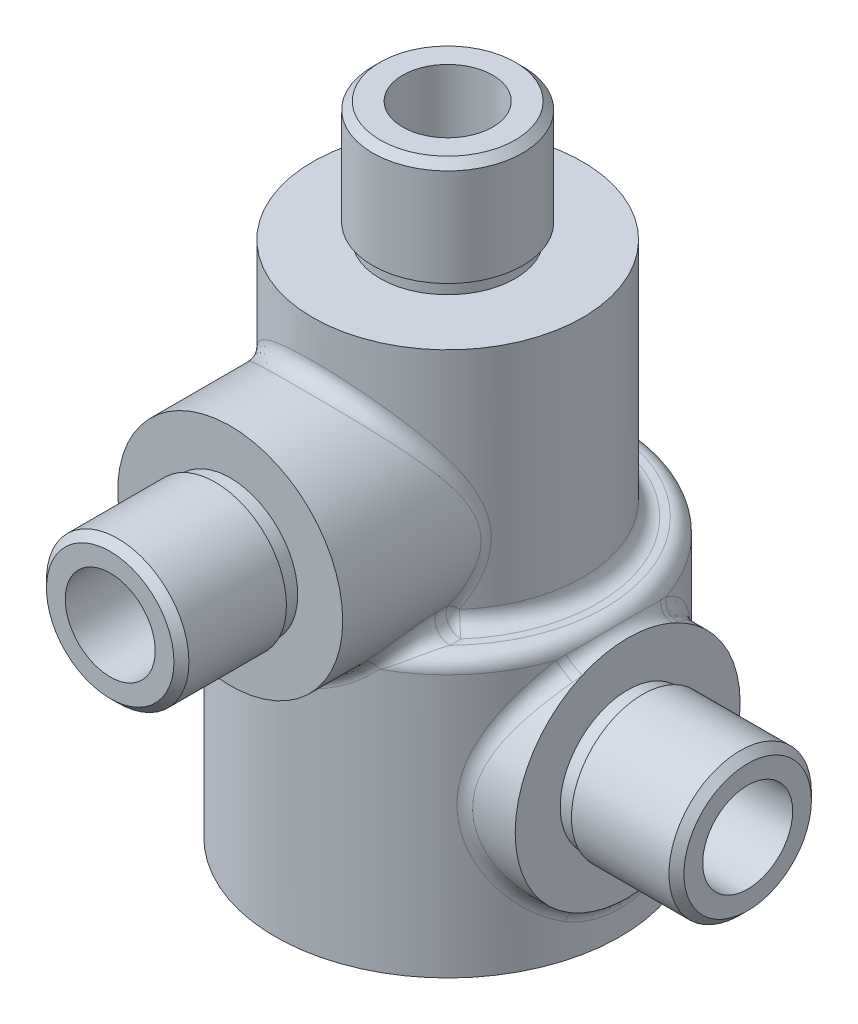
SolidWorks part; units mm, degrees
ref_plane "前视" through (0, 0, 0) normal (0, 0, 1) x (1, 0, 0)
ref_plane "上视" through (0, 0, 0) normal (0, 1, 0) x (1, 0, 0)
ref_plane "右视" through (0, 0, 0) normal (1, 0, 0) x (0, 0, -1)
sketch "草图1" plane through (0, 0, 0) normal (0, 0, 1) x (1, 0, 0)
  line L0 (0, 101.854) -> (0, -107.442) construction
  line L1 (0, -48.514) -> (-18, -48.514)
  line L2 (-18, -48.514) -> (-18, 20.486)
  line L3 (-18, 20.486) -> (-9, 20.486)
  line L4 (-9, 20.486) -> (-9, 36.486)
  line L5 (-9, 36.486) -> (0, 36.486)
  line L6 (0, -48.514) -> (0, 36.486)
  dimension "D1" = 85
  dimension "D2" = 9
  dimension "D3" = 18
  dimension "D4" = 16
revolve "旋转3" add sketch "草图1" angle 360 about L0
sketch "草图2" plane through (0, 0, 0) normal (0, 0, 1) x (1, 0, 0)
  circle A0 centre (0, -1.514) radius 15
  dimension "D2" = 30
extrude "拉伸2" add sketch "草图2" along normal blind 29
sketch "草图4" plane through (0, 0, 0) normal (1, 0, 0) x (0, 0, -1)
  circle A0 centre (0, -28.514) radius 15
  dimension "D3" = 30
extrude "拉伸3" add sketch "草图4" along normal blind 24
sketch "草图5" plane through (0, 0, 29) normal (0, 0, 1) x (1, 0, 0)
  circle A0 centre (0, -1.514) radius 9
  circle A1 centre (0, -1.514) radius 15 construction
  dimension "D1" = 18
extrude "拉伸4" add sketch "草图5" along normal blind 16
sketch "草图6" plane through (24, 0, 0) normal (1, 0, 0) x (0, 0, -1)
  circle A0 centre (0, -28.514) radius 9
  circle A1 centre (0, -28.514) radius 15 construction
  dimension "D1" = 18
extrude "拉伸5" add sketch "草图6" along normal blind 16
sketch "草图9" plane through (0, -48.514, 0) normal (0, -1, 0) x (1, 0, 0)
  line L0 (24, 0) -> (9.9499, 0) construction
  circle A0 centre (0, 0) radius 6
  circle A1 centre (0, 0) radius 18 construction
  dimension "D1" = 12
extrude "切除-拉伸2" cut sketch "草图9" against normal through all
sketch "草图10" plane through (0, -48.514, 0) normal (0, -1, 0) x (1, 0, 0)
  circle A0 centre (0, 0) radius 9
  circle A1 centre (0, 0) radius 18 construction
  dimension "D1" = 18
extrude "切除-拉伸3" cut sketch "草图10" against normal blind 60
sketch "草图11" plane through (0, -48.514, 0) normal (0, -1, 0) x (1, 0, 0)
  circle A0 centre (0, 0) radius 13.5
  circle A1 centre (0, 0) radius 18 construction
  dimension "D1" = 27
extrude "切除-拉伸4" cut sketch "草图11" against normal blind 32
sketch "草图12" plane through (0, 0, 45) normal (0, 0, 1) x (1, 0, 0)
  circle A0 centre (0, -1.514) radius 6
  circle A1 centre (0, -1.514) radius 9 construction
  dimension "D1" = 12
extrude "切除-拉伸5" cut sketch "草图12" against normal blind 42
sketch "草图13" plane through (40, 0, 0) normal (1, 0, 0) x (0, 0, -1)
  line L0 (0, 11.486) -> (0, -16.514) construction
  circle A0 centre (0, -28.514) radius 6
  circle A1 centre (0, -28.514) radius 9 construction
  dimension "D1" = 12
extrude "切除-拉伸6" cut sketch "草图13" against normal blind 42
sketch "草图14" plane through (0, -48.514, 0) normal (0, -1, 0) x (1, 0, 0)
  line L0 (24, 0) -> (9.9499, 0) construction
  circle A0 centre (0, 0) radius 23
  circle A1 centre (0, 0) radius 18 construction
  dimension "D1" = 46
extrude "拉伸6" add sketch "草图14" against normal blind 37
sketch "草图15" plane through (0, 36.486, 0) normal (0, 1, 0) x (-1, 0, 0)
  line L0 (0, 29) -> (0, 20.0998) construction
  circle A0 centre (0, 0) radius 6
  circle A1 centre (0, 0) radius 6 construction
extrude "切除-拉伸7" cut sketch "草图15" against normal through all
sketch "草图16" plane through (0, -48.514, 0) normal (0, -1, 0) x (1, 0, 0)
  line L0 (0, 29) -> (0, 20.0998) construction
  circle A0 centre (0, 0) radius 9
  circle A1 centre (0, 0) radius 6 construction
  dimension "D1" = 18
extrude "切除-拉伸9" cut sketch "草图16" against normal blind 60
sketch "草图17" plane through (0, -48.514, 0) normal (0, -1, 0) x (1, 0, 0)
  line L0 (24, 0) -> (17.4357, 0) construction
  circle A0 centre (0, 0) radius 13.5
  circle A1 centre (0, 0) radius 9 construction
  dimension "D1" = 27
extrude "切除-拉伸10" cut sketch "草图17" against normal blind 32
fillet "圆角1" radius 2
fillet "圆角4" radius 2
sketch "草图19" plane through (40, 0, 0) normal (1, 0, 0) x (0, 0, -1)
  line L0 (0, 11.486) -> (0, -16.514) construction
  circle A0 centre (0, -28.514) radius 9.5
  circle A1 centre (0, -28.514) radius 9 construction
  dimension "D1" = 19
extrude "拉伸8" add sketch "草图19" against normal blind 14
sketch "草图20" plane through (40, 0, 0) normal (1, 0, 0) x (0, 0, -1)
  line L0 (0, 11.486) -> (0, -16.514) construction
  circle A0 centre (0, -28.514) radius 6
  circle A1 centre (0, -28.514) radius 9.5 construction
  dimension "D1" = 12
extrude "切除-拉伸11" cut sketch "草图20" against normal blind 36
sketch "草图21" plane through (0, 0, 45) normal (0, 0, 1) x (1, 0, 0)
  circle A0 centre (0, -1.514) radius 9.5
  circle A1 centre (0, -1.514) radius 9 construction
  dimension "D1" = 19
extrude "拉伸9" add sketch "草图21" against normal blind 14
sketch "草图23" plane through (0, 0, 45) normal (0, 0, 1) x (1, 0, 0)
  circle A0 centre (0, -1.514) radius 6
  circle A1 centre (0, -1.514) radius 9.5 construction
  dimension "D1" = 12
extrude "切除-拉伸13" cut sketch "草图23" against normal blind 44
chamfer "倒角3" distance 1 angle 45
chamfer "倒角4" distance 1 angle 45
fillet "圆角5" radius 2
fillet "圆角6" radius 2
sketch "草图24" plane through (0, 36.486, 0) normal (0, 1, 0) x (-1, 0, 0)
  circle A0 centre (0, 0) radius 10
  circle A1 centre (0, 0) radius 9 construction
  circle A3 centre (0, 0) radius 6
  circle A4 centre (0, 0) radius 6 construction
  dimension "D1" = 20
extrude "拉伸10" add sketch "草图24" against normal blind 14
chamfer "倒角5" distance 1 angle 45
